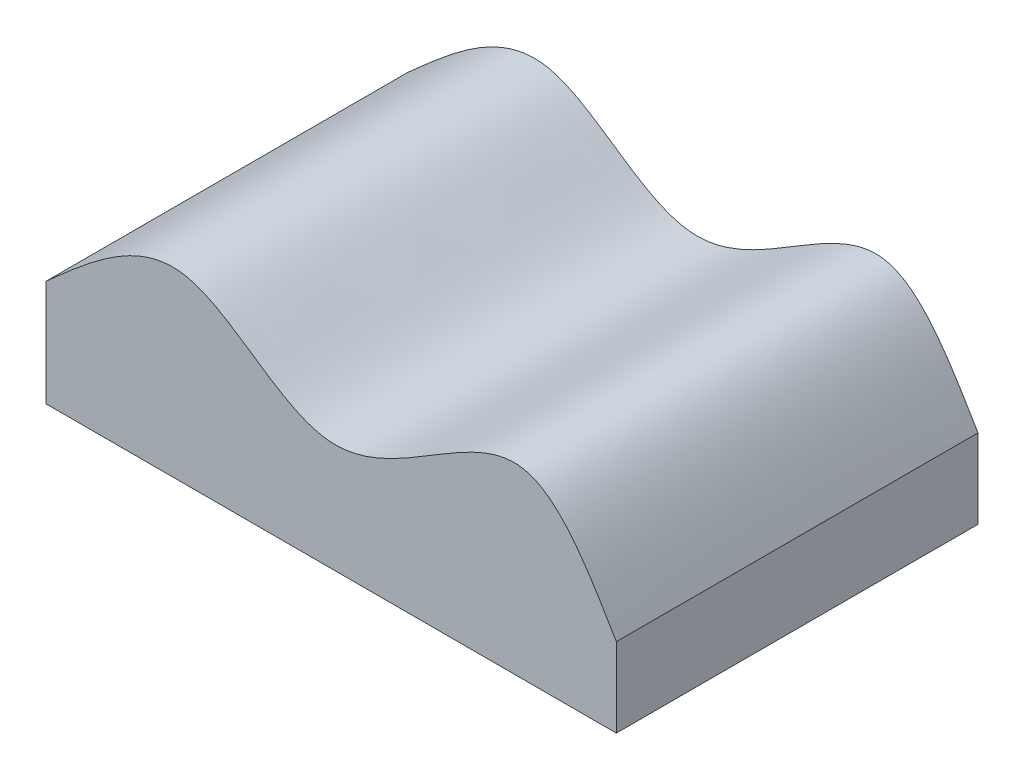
SolidWorks part; units mm, degrees
ref_plane "Front" through (0, 0, 0) normal (0, 0, 1) x (1, 0, 0)
ref_plane "Top" through (0, 0, 0) normal (0, 1, 0) x (1, 0, 0)
ref_plane "Right" through (0, 0, 0) normal (1, 0, 0) x (0, 0, -1)
ref_plane "Plane1" through (0, 0, 75.1895) normal (0, 0, 1) x (1, 0, 0)
sketch "Sketch1" plane through (0, 0, 0) normal (0, 0, 1) x (-1, 0, 0)
  line L0 (-55.9862, 0) -> (55.9862, 0)
  line L1 (-55.9862, 0) -> (-55.9862, -15.5517)
  line L2 (55.9862, -20.8393) -> (55.9862, 0)
  spline S0 degree 3 poles (-55.9862, -15.5517) (-50.3043, -25.2108) (-36.391, -48.863) (-1.4055, -7.2671) (28.4753, -45.4256) (46.9508, -28.9141) (55.9862, -20.8393) knots 0 0 0 0 0.211458 0.517797 0.764183 1 1 1 1
extrude "Extrude1" add sketch "Sketch1" along normal mid plane 71
ref_plane "Plane2" through (0, 56.0728, 0) normal (0, 1, 0) x (1, 0, 0)
sketch "Sketch2" plane through (0, 56.0728, 0) normal (0, 1, 0) x (1, 0, 0)
  line L1 (-19.4679, 19.9486) -> (19.4679, 19.9486)
  line L3 (-19.4679, -19.9486) -> (19.4679, -19.9486)
  arc A0 (-19.4679, 19.9486) -> (-19.4679, -19.9486) centre (-19.4679, 0) ccw
  arc A1 (19.4679, -19.9486) -> (19.4679, 19.9486) centre (19.4679, 0) ccw
